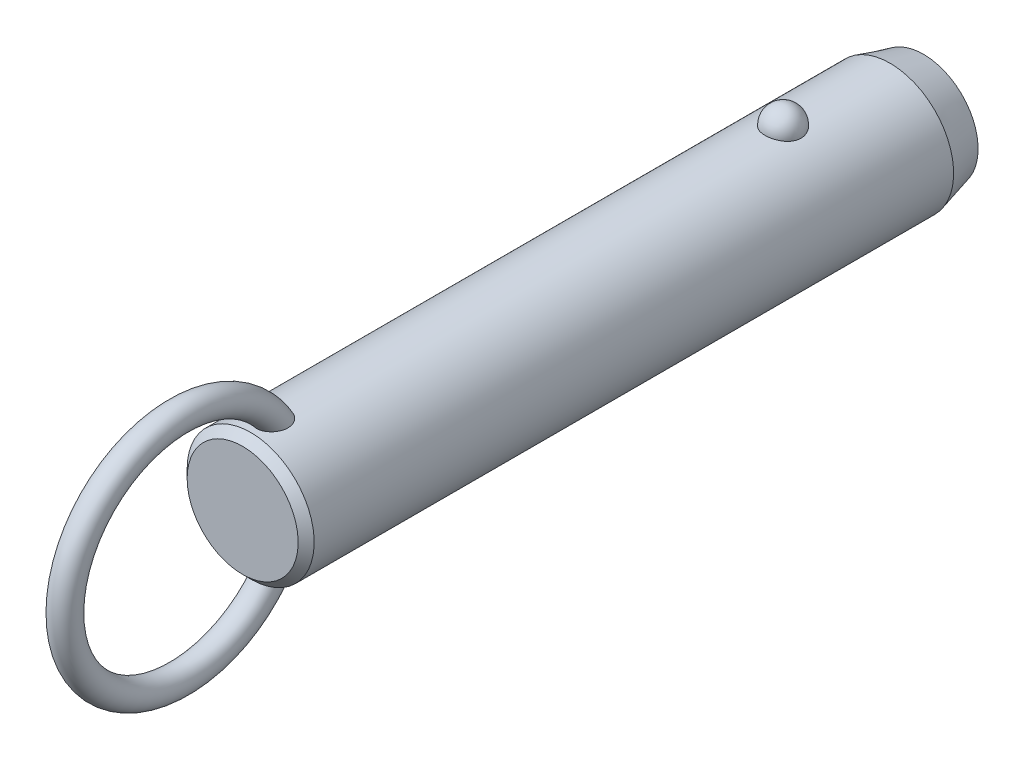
SolidWorks part; units mm, degrees
ref_plane "Front Plane" through (0, 0, 0) normal (0, 0, 1) x (1, 0, 0)
ref_plane "Top Plane" through (0, 0, 0) normal (0, 1, 0) x (1, 0, 0)
ref_plane "Right Plane" through (0, 0, 0) normal (1, 0, 0) x (0, 0, -1)
sketch "Sketch2" plane through (0, 0, 0) normal (0, 0, 1) x (1, 0, 0)
  circle A0 centre (0, 0) radius 9.5
  point P3 (0, 9.5)
  dimension "D1" = 19
extrude "Boss-Extrude1" add sketch "Sketch2" along normal blind 68.6
sketch "Sketch3" plane through (0, 0, 0) normal (0, 0, -1) x (-1, 0, 0)
  circle A0 centre (0, 0) radius 9.5
  dimension "D1" = 19
extrude "Boss-Extrude2" add sketch "Sketch3" along normal blind 23.7
chamfer "Chamfer1" distance 5 angle 15 1 edges at (-9.5, 0, -23.7)
sketch "Sketch12" plane through (0, 0, 0) normal (1, 0, 0) x (0, 0, -1)
  line L0 (-68.6, 9.5) -> (-68.6, -9.5) construction
  point P0 (-68.6, 0)
sketch "Sketch13" plane through (0, 0, 0) normal (1, 0, 0) x (0, 0, -1)
  circle A0 centre (-87.65, 0) radius 19.05
  point P2 (-68.6, 0)
  dimension "D1" = 38.1
sketch "Sketch14" plane through (0, 0, 0) normal (0, 1, 0) x (1, 0, 0)
  circle A0 centre (0, -70.6) radius 2
  point P2 (0, -68.6)
  dimension "D1" = 4
sweep "Sweep1" add profiles "Sketch14" path "Sketch13"
sketch "Sketch15" plane through (0, 0, 68.6) normal (0, 0, 1) x (1, 0, 0)
  circle A0 centre (0, 0) radius 9.5
  dimension "D1" = 19
extrude "Boss-Extrude3" add sketch "Sketch15" along normal blind 9.52
chamfer "Chamfer2" distance 1.2 angle 45 1 edges at (9.5, 0, 78.12)
sketch "Sketch18" plane through (0, 0, 0) normal (1, 0, 0) x (0, 0, -1)
  line L0 (18.7, 9.5) -> (-71.1378, 9.5) construction
  line L1 (2.7, 12.2) -> (2.7, 6.8)
  line L2 (-71.1378, -9.5) -> (18.7, -9.5) construction
  arc A0 (2.7, 12.2) -> (2.7, 6.8) centre (2.7, 9.5) ccw
  point P4 (0, 9.5)
  dimension "D1" = 21.7
revolve "Revolve1" add sketch "Sketch18" angle 360 about L1
